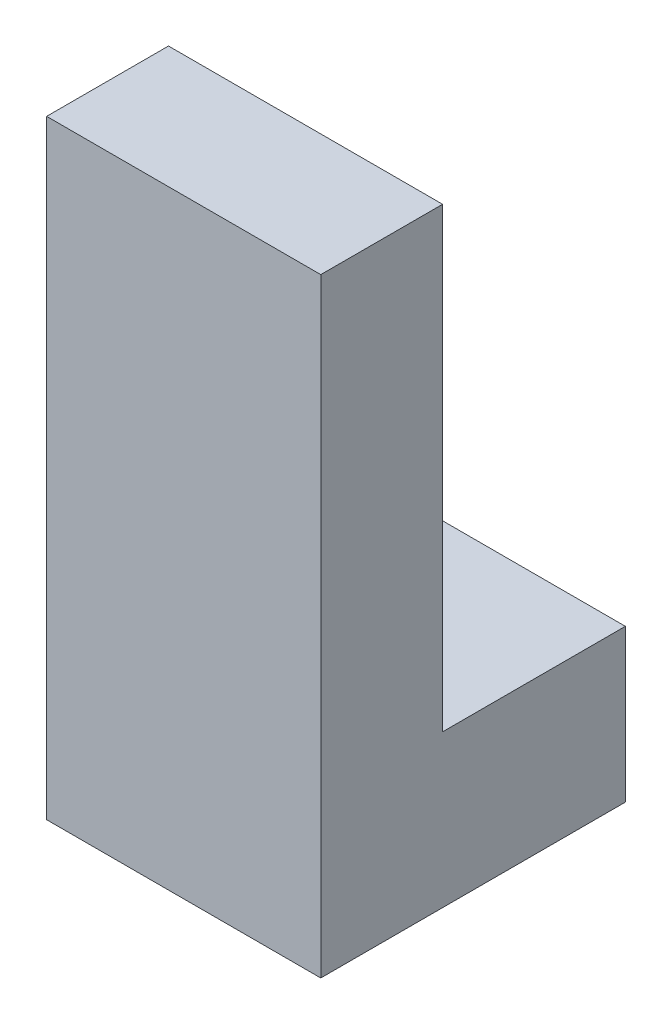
SolidWorks part; units mm, degrees
ref_plane "Front Plane" through (0, 0, 0) normal (0, 0, 1) x (1, 0, 0)
ref_plane "Top Plane" through (0, 0, 0) normal (0, 1, 0) x (1, 0, 0)
ref_plane "Right Plane" through (0, 0, 0) normal (1, 0, 0) x (0, 0, -1)
sketch "Sketch2" plane through (0, 0, 0) normal (0, 1, 0) x (1, 0, 0)
  line L1 (0, 0) -> (3.6, 0)
  line L2 (0, 0) -> (0, 4)
  line L3 (0, 4) -> (3.6, 4)
  line L4 (3.6, 0) -> (3.6, 4)
  dimension "D1" = 3.6
  dimension "D2" = 4
extrude "Boss-Extrude1" add sketch "Sketch2" along normal blind 8
sketch "Sketch4" plane through (0, 8, 0) normal (0, 1, 0) x (1, 0, 0)
  line L0 (3.6, 0) -> (3.6, 4) construction
  line L1 (0, 4) -> (3.6, 4)
  line L2 (0, 4) -> (0, 1.6)
  line L3 (0, 1.6) -> (3.6, 1.6)
  line L4 (3.6, 4) -> (3.6, 1.6)
  dimension "D1" = 2.4
extrude "Cut-Extrude2" cut sketch "Sketch4" against normal offset from surface (6 mm away) 2
